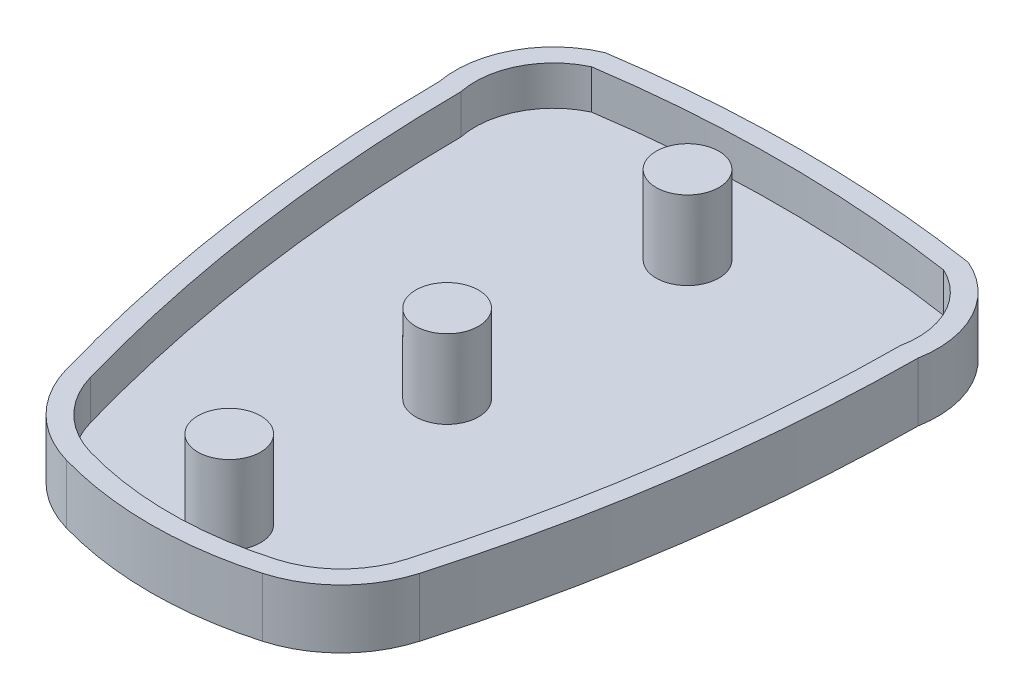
SolidWorks part; units mm, degrees
ref_plane "Front Plane" through (0, 0, 0) normal (0, 0, 1) x (1, 0, 0)
ref_plane "Top Plane" through (0, 0, 0) normal (0, 1, 0) x (1, 0, 0)
ref_plane "Right Plane" through (0, 0, 0) normal (1, 0, 0) x (0, 0, -1)
sketch "Sketch1" plane through (0, 0, 0) normal (0, 1, 0) x (1, 0, 0)
  line L0 (-9.25, 0) -> (9.25, 0) construction
  line L1 (9.25, 0) -> (12.2, -5.5) construction
  line L2 (12.2, -5.5) -> (9, -27.7) construction
  line L3 (9, -27.7) -> (5, -31.7) construction
  line L4 (5, -31.7) -> (-5, -31.7) construction
  line L5 (-5, -31.7) -> (-9, -27.7) construction
  line L6 (-9, -27.7) -> (-12.2, -5.5) construction
  line L7 (-12.2, -5.5) -> (-9.25, 0) construction
  line L8 (0, 0) -> (0, -31.7) construction
  line L9 (-12.2, -5.5) -> (12.2, -5.5) construction
  line L10 (-9, -27.7) -> (9, -27.7) construction
  line L11 (0, -32.4) -> (544.2223, -32.4) construction
  line L12 (0, 0.7) -> (25.6039, 0.7) construction
  arc A0 (-12.2, -5.5) -> (-9.25, 0) centre (-7.2823, -4.5965) cw
  arc A1 (-12.2, -5.5) -> (-9, -27.7) centre (71.1014, -4.8232) ccw
  arc A2 (-5, -31.7) -> (-9, -27.7) centre (-3.4009, -26.1009) cw
  arc A3 (-5, -31.7) -> (5, -31.7) centre (0, -14.1929) ccw
  arc A4 (-9.25, 0) -> (9.25, 0) centre (0, -60.7661) cw
  arc A5 (5, -31.7) -> (9, -27.7) centre (3.4009, -26.1009) ccw
  arc A6 (12.2, -5.5) -> (9, -27.7) centre (-71.1014, -4.8232) cw
  arc A7 (12.2, -5.5) -> (9.25, 0) centre (7.2823, -4.5965) ccw
  arc A8 (-11.2007, -5.4002) -> (-8.9669, -0.9686) centre (-7.2823, -4.5965) cw
  arc A9 (-8.9669, -0.9686) -> (8.9669, -0.9686) centre (0, -60.7661) cw
  arc A10 (11.2007, -5.4002) -> (8.9669, -0.9686) centre (7.2823, -4.5965) ccw
  arc A11 (11.2007, -5.4002) -> (8.0384, -27.4254) centre (-71.1014, -4.8232) cw
  arc A12 (4.7254, -30.7384) -> (8.0384, -27.4254) centre (3.4009, -26.1009) ccw
  arc A13 (-4.7254, -30.7384) -> (4.7254, -30.7384) centre (0, -14.1929) ccw
  arc A14 (-4.7254, -30.7384) -> (-8.0384, -27.4254) centre (-3.4009, -26.1009) cw
  arc A15 (-11.2007, -5.4002) -> (-8.0384, -27.4254) centre (71.1014, -4.8232) ccw
  arc A16 (-12.2, -5.5) -> (-9.25, 0) centre (-7.2823, -4.5965) cw construction
  point P9 (0, 0)
  point P10 (0, 0)
  point P40 (0, 0)
  point P41 (0, 0)
  point P42 (13.4543, -5.363)
  point P43 (-8.6577, -3.8913)
  dimension "D7" = 33.1
  dimension "D9" = 1
  dimension "D11" = 5
  dimension "D1" = 0.7
  dimension "D2" = 18
  dimension "D3" = 10
  dimension "D4" = 4
  dimension "D5" = 18.5
  dimension "D6" = 5.5
  dimension "D8" = 0.7
  dimension "D10" = 24.4
extrude "Boss-Extrude1" add sketch "Sketch1" along normal blind 2
sketch "Sketch2" plane through (0, 0, 0) normal (0, -1, 0) x (1, 0, 0)
  arc A0 (-12.2, 5.5) -> (-9.25, 0) centre (-7.2823, 4.5965) ccw construction
  arc A1 (-9.25, 0) -> (9.25, 0) centre (0, 60.7661) ccw construction
  arc A2 (9.25, 0) -> (12.2, 5.5) centre (7.2823, 4.5965) ccw construction
  arc A3 (12.2, 5.5) -> (9, 27.7) centre (-71.1014, 4.8232) ccw construction
  arc A4 (9, 27.7) -> (5, 31.7) centre (3.4009, 26.1009) ccw construction
  arc A5 (5, 31.7) -> (-5, 31.7) centre (0, 14.1929) ccw construction
  arc A6 (-5, 31.7) -> (-9, 27.7) centre (-3.4009, 26.1009) ccw construction
  arc A7 (-9, 27.7) -> (-12.2, 5.5) centre (71.1014, 4.8232) ccw construction
  arc A8 (-12.2, 5.5) -> (-9.25, 0) centre (-7.2823, 4.5965) ccw
  arc A9 (-9.25, 0) -> (9.25, 0) centre (0, 60.7661) ccw
  arc A10 (9.25, 0) -> (12.2, 5.5) centre (7.2823, 4.5965) ccw
  arc A11 (12.2, 5.5) -> (9, 27.7) centre (-71.1014, 4.8232) ccw
  arc A12 (9, 27.7) -> (5, 31.7) centre (3.4009, 26.1009) ccw
  arc A13 (5, 31.7) -> (-5, 31.7) centre (0, 14.1929) ccw
  arc A14 (-5, 31.7) -> (-9, 27.7) centre (-3.4009, 26.1009) ccw
  arc A15 (-9, 27.7) -> (-12.2, 5.5) centre (71.1014, 4.8232) ccw
extrude "Boss-Extrude2" add sketch "Sketch2" along normal blind 1
sketch "Sketch3" plane through (0, 0, 0) normal (0, 1, 0) x (1, 0, 0)
  line L0 (0, -0.3) -> (0, -31.4) construction
  arc A0 (8.9669, -0.9686) -> (-8.9669, -0.9686) centre (0, -60.7661) ccw construction
  arc A1 (-4.7254, -30.7384) -> (4.7254, -30.7384) centre (0, -14.1929) ccw construction
  circle A2 centre (0, -5.05) radius 1.6
  circle A3 centre (0, -17.3) radius 1.6
  circle A4 centre (0, -28.4) radius 1.6
  point P16 (0, -16.4807)
  point P17 (0, -0.7821)
  dimension "D4" = 17
  dimension "D5" = 4.75
  dimension "D6" = 28.1
extrude "Boss-Extrude3" add sketch "Sketch3" along normal blind 4
sketch "Sketch6" plane through (0, -1, 0) normal (0, -1, 0) x (-1, 0, 0)
  line L0 (-1.4142, -24.9858) -> (1.4142, -24.9858) construction
  line L1 (-11, -10.575) -> (11, -10.575)
  line L2 (-11, -10.575) -> (-11, -11.775)
  line L3 (-11, -11.775) -> (11, -11.775)
  line L4 (11, -10.575) -> (11, -11.775)
  line L5 (-11, -10.575) -> (11, -11.775) construction
  line L6 (-11, -11.775) -> (11, -10.575) construction
  line L7 (-8.5, -22.25) -> (8.5, -22.25)
  line L8 (-8.5, -22.25) -> (-8.5, -23.45)
  line L9 (-8.5, -23.45) -> (8.5, -23.45)
  line L10 (8.5, -22.25) -> (8.5, -23.45)
  line L11 (-8.5, -22.25) -> (8.5, -23.45) construction
  line L12 (-8.5, -23.45) -> (8.5, -22.25) construction
  line L13 (0, -28.4) -> (0, -25.0198) construction
  line L15 (-2.2627, -24.1373) -> (-1.4142, -24.9858) construction
  line L16 (1.8385, -24.5615) -> (0, -26.4) construction
  line L17 (0, -26.4) -> (-1.8385, -24.5615) construction
  line L18 (3.6799, -15.423) -> (4.5284, -16.2716) construction
  line L19 (-4.3, -17.9) -> (-4.3, -19.1) construction
  line L20 (0, -5.05) -> (0, -6.05) construction
  line L24 (1.7, -19.1) -> (4.5284, -16.2716)
  line L25 (1.2029, -17.9) -> (3.6799, -15.423)
  line L26 (1.2029, -17.9) -> (-4.3, -17.9)
  line L27 (1.7, -19.1) -> (-4.3, -19.1)
  circle A2 centre (0, -6.05) radius 2
  circle A3 centre (0, -6.05) radius 3.2
  circle A4 centre (0, -26.4) radius 2 construction
  arc A5 (-1.4142, -24.9858) -> (-0.3171, -28.3747) centre (0, -26.4) ccw
  arc A6 (-2.2627, -24.1373) -> (-0.5074, -29.5595) centre (0, -26.4) ccw
  arc A7 (-2.2627, -24.1373) -> (-1.4142, -24.9858) centre (-1.8385, -24.5615) cw
  arc A8 (1.4142, -24.9858) -> (-0.3171, -28.3747) centre (0, -26.4) cw
  arc A9 (2.2627, -24.1373) -> (-0.5074, -29.5595) centre (0, -26.4) cw
  arc A10 (2.2627, -24.1373) -> (1.4142, -24.9858) centre (1.8385, -24.5615) ccw
  arc A11 (4.5284, -16.2716) -> (3.6799, -15.423) centre (4.1042, -15.8473) ccw
  arc A12 (-4.3, -19.1) -> (-4.3, -17.9) centre (-4.3, -18.5) cw
  dimension "D6" = 4
  dimension "D7" = 4
  dimension "D11" = 6
  dimension "D2" = 17
  dimension "D3" = 22
  dimension "D4" = 2
  dimension "D9" = 90
  dimension "D12" = 4
  dimension "D15" = 135
  dimension "D5" = 1
extrude "Cut-Extrude3" cut sketch "Sketch6" against normal blind 0.5
sketch "Sketch7" plane through (0, -1, 0) normal (0, -1, 0) x (1, 0, 0)
  arc A8 (-4.4508, 29.7769) -> (-7.0769, 27.1508) centre (-3.4009, 26.1009) ccw
  arc A9 (-7.0769, 27.1508) -> (-10.2014, 5.2885) centre (71.1014, 4.8232) ccw
  arc A10 (-10.2014, 5.2885) -> (-8.6664, 1.9349) centre (-7.2823, 4.5965) ccw
  arc A11 (-8.6664, 1.9349) -> (8.6664, 1.9349) centre (0, 60.7661) ccw
  arc A12 (8.6664, 1.9349) -> (10.2014, 5.2885) centre (7.2823, 4.5965) ccw
  arc A13 (10.2014, 5.2885) -> (7.0769, 27.1508) centre (-71.1014, 4.8232) ccw
  arc A14 (7.0769, 27.1508) -> (4.4508, 29.7769) centre (3.4009, 26.1009) ccw
  arc A15 (4.4508, 29.7769) -> (-4.4508, 29.7769) centre (0, 14.1929) ccw
  arc A16 (-11.2007, 5.4002) -> (-8.9669, 0.9686) centre (-7.2823, 4.5965) ccw
  arc A17 (-8.9669, 0.9686) -> (8.9669, 0.9686) centre (0, 60.7661) ccw
  arc A18 (8.9669, 0.9686) -> (11.2007, 5.4002) centre (7.2823, 4.5965) ccw
  arc A19 (11.2007, 5.4002) -> (8.0384, 27.4254) centre (-71.1014, 4.8232) ccw
  arc A20 (8.0384, 27.4254) -> (4.7254, 30.7384) centre (3.4009, 26.1009) ccw
  arc A21 (4.7254, 30.7384) -> (-4.7254, 30.7384) centre (0, 14.1929) ccw
  arc A22 (-4.7254, 30.7384) -> (-8.0384, 27.4254) centre (-3.4009, 26.1009) ccw
  arc A23 (-8.0384, 27.4254) -> (-11.2007, 5.4002) centre (71.1014, 4.8232) ccw
  arc A24 (-11.2007, 5.4002) -> (-8.9669, 0.9686) centre (-7.2823, 4.5965) ccw
  arc A25 (-8.9669, 0.9686) -> (8.9669, 0.9686) centre (0, 60.7661) ccw
  arc A26 (8.9669, 0.9686) -> (11.2007, 5.4002) centre (7.2823, 4.5965) ccw
  arc A27 (11.2007, 5.4002) -> (8.0384, 27.4254) centre (-71.1014, 4.8232) ccw
  arc A28 (8.0384, 27.4254) -> (4.7254, 30.7384) centre (3.4009, 26.1009) ccw
  arc A29 (4.7254, 30.7384) -> (-4.7254, 30.7384) centre (0, 14.1929) ccw
  arc A30 (-4.7254, 30.7384) -> (-8.0384, 27.4254) centre (-3.4009, 26.1009) ccw
  arc A31 (-8.0384, 27.4254) -> (-11.2007, 5.4002) centre (71.1014, 4.8232) ccw
  dimension "D1" = 1
  dimension "D2" = 1
extrude "Cut-Extrude4" cut sketch "Sketch7" against normal blind 0.5
